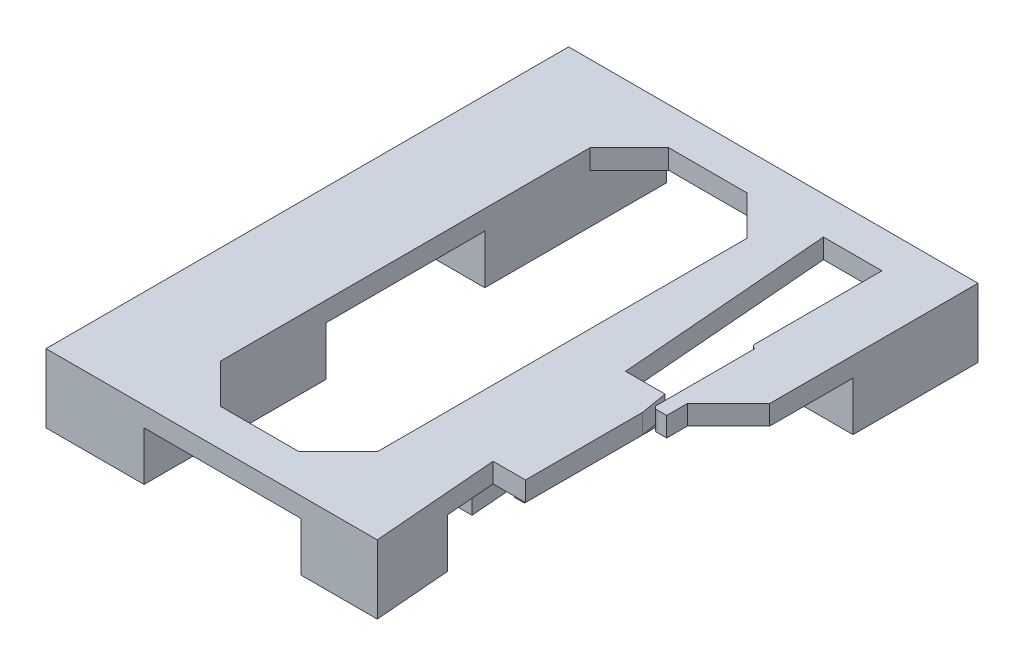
SolidWorks part; units mm, degrees
ref_plane "Front Plane" through (0, 0, 0) normal (0, 0, 1) x (1, 0, 0)
ref_plane "Top Plane" through (0, 0, 0) normal (0, 1, 0) x (1, 0, 0)
ref_plane "Right Plane" through (0, 0, 0) normal (1, 0, 0) x (0, 0, -1)
sketch "Sketch11" plane through (0, 0, 0) normal (0, 1, 0) x (1, 0, 0)
  line L0 (47.85, 5.4) -> (47.85, 26.65)
  line L1 (47.85, 5.4) -> (43.65, 1.2)
  line L5 (42.25, 8.3) -> (42.25, 9.5)
  line L6 (43.65, 1.2) -> (43.65, -0.9)
  line L7 (41.85, 9.9) -> (41.85, 22.85)
  line L8 (37.6615, 0.9) -> (41.6826, 0.9)
  line L10 (42.65, -0.9) -> (43.65, -0.9)
  line L16 (6.1, 26.65) -> (6.1, -26.65)
  line L17 (28.1, -22.85) -> (32.1, -18.85)
  line L19 (16.1, 18.85) -> (16.1, -18.85)
  line L20 (32.1, -18.85) -> (32.1, 18.85)
  line L21 (16.1, -18.85) -> (20.1, -22.85)
  line L22 (41.6826, 0.9) -> (42.15, -1.8733)
  line L23 (20.1, -22.85) -> (28.1, -22.85)
  line L24 (20.1, 22.85) -> (28.1, 22.85)
  line L25 (42.25, 8.3) -> (42.25, -0.5)
  line L26 (20.1, 22.85) -> (16.1, 18.85)
  line L27 (28.1, 22.85) -> (32.1, 18.85)
  line L28 (42.15, -1.8733) -> (42.15, -13.9)
  line L29 (42.15, -13.8) -> (38.8468, -13.8)
  line L30 (39.8829, -26.65) -> (38.8468, -13.8)
  line L32 (41.85, 22.85) -> (35.8916, 22.85)
  line L33 (35.8916, 22.85) -> (37.6615, 0.9)
  line L34 (39.8829, -26.65) -> (6.1, -26.65)
  line L36 (6.1, 26.65) -> (47.85, 26.65)
  arc A0 (41.85, 9.9) -> (42.25, 9.5) centre (42.25, 9.9) ccw
  arc A1 (42.25, -0.5) -> (42.65, -0.9) centre (42.65, -0.5) ccw
  point P9 (32.1, -22.85)
  point P17 (32.1, 22.85)
  point P50 (16.1, -22.85)
  point P55 (16.1, 22.85)
  point P72 (43.65, 5.2)
  dimension "D7" = 0
sketch "Sketch12" plane through (0, 0, 0) normal (0, 1, 0) x (1, 0, 0)
  line L4 (16.1, 26.65) -> (6.1, 26.65)
  line L6 (32.1, -8.2) -> (35.1897, -8.2)
  line L7 (16.1, -26.65) -> (6.1, -26.65)
  line L9 (32.1, -8.2) -> (32.1, -12.65)
  line L20 (16.1, -8.1) -> (6.1, -8.1)
  line L22 (6.1, -8.1) -> (6.1, -26.65)
  line L23 (16.1, -8.1) -> (16.1, -26.65)
  line L24 (16.1, 8.1) -> (16.1, 26.65)
  line L25 (6.1, 8.1) -> (6.1, 26.65)
  line L26 (16.1, 26.65) -> (16.1, -26.65) construction
  line L31 (35.5485, -12.65) -> (35.1897, -8.2)
  line L34 (32.1, -12.65) -> (35.5485, -12.65)
  line L35 (39.254, -18.85) -> (32.1, -18.85)
  line L36 (32.1, -18.85) -> (32.1, -26.65)
  line L37 (32.1, -26.65) -> (39.8829, -26.65)
  line L38 (39.254, -18.85) -> (39.8829, -26.65)
  line L39 (16.1, 8.1) -> (6.1, 8.1)
  line L40 (6.1, 26.65) -> (6.1, -26.65) construction
  dimension "D3" = 16
sketch "Sketch13" plane through (0, 0, 0) normal (0, 1, 0) x (1, 0, 0)
  line L1 (43.25, 13.5) -> (42.25, 13.5)
  line L2 (43.25, 13.5) -> (43.25, -0.5)
  line L3 (43.25, -0.5) -> (42.25, -0.5)
  line L4 (42.25, 13.5) -> (42.25, -0.5)
  line L5 (40.75, 0.5) -> (41.75, 0.5)
  line L6 (40.75, 0.5) -> (40.75, -13.5)
  line L7 (40.75, -13.5) -> (41.75, -13.5)
  line L8 (41.75, 0.5) -> (41.75, -13.5)
extrude "Boss-Extrude1" add sketch "Sketch11" along normal blind 2
extrude "Boss-Extrude2" add sketch "Sketch12" against normal blind 5
extrude "Boss-Extrude3" add sketch "Sketch13" against normal blind 0.4
sketch "Sketch14" plane through (0, 0, 0) normal (0, 1, 0) x (1, 0, 0)
  line L0 (47.85, 13.9) -> (41.85, 13.9)
  line L4 (47.85, 26.65) -> (41.85, 26.65)
  line L6 (47.85, 26.65) -> (47.85, 13.9)
  line L8 (41.85, 26.65) -> (41.85, 13.9)
extrude "Boss-Extrude4" add sketch "Sketch14" against normal blind 5
